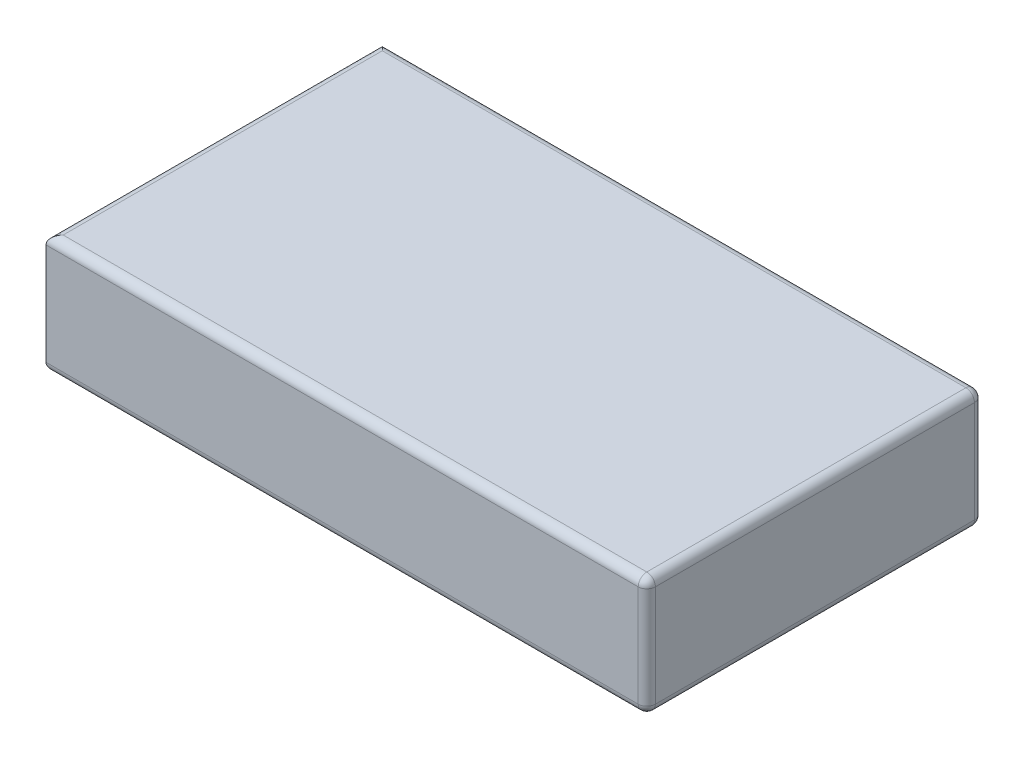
SolidWorks part; units mm, degrees
ref_plane "Front Plane" through (0, 0, 0) normal (0, 0, 1) x (1, 0, 0)
ref_plane "Top Plane" through (0, 0, 0) normal (0, 1, 0) x (1, 0, 0)
ref_plane "Right Plane" through (0, 0, 0) normal (1, 0, 0) x (0, 0, -1)
sketch "Sketch1" plane through (0, 0, 0) normal (1, 0, 0) x (0, 0, -1)
  line L1 (-9.795, 3.46) -> (9.795, 3.46)
  line L2 (-9.795, 3.46) -> (-9.795, -3.46)
  line L3 (-9.795, -3.46) -> (9.795, -3.46)
  line L4 (9.795, 3.46) -> (9.795, -3.46)
  line L5 (-9.795, 3.46) -> (9.795, -3.46) construction
  line L6 (-9.795, -3.46) -> (9.795, 3.46) construction
  point P0 (0, 0)
  dimension "D1" = 6.92
  dimension "D2" = 19.59
extrude "Boss-Extrude1" add sketch "Sketch1" along normal blind 35
sketch "Sketch3" plane through (0, 0, 0) normal (-1, 0, 0) x (0, 0, 1)
  line L0 (-5.858, 0) -> (-9.795, 0) construction
  line L1 (-9.795, -3.46) -> (-9.795, 3.46) construction
  line L2 (5.858, 0) -> (9.795, 0) construction
  line L3 (9.795, 3.46) -> (9.795, -3.46) construction
  circle A0 centre (-5.858, 0) radius 2.16
  circle A1 centre (5.858, 0) radius 2.16
  dimension "D1" = 4.32
  dimension "D2" = 3.937
extrude "Cut-Extrude3" cut sketch "Sketch3" against normal blind 12
fillet "Fillet1" radius 0.5 10 edges at (17.5, -3.46, 9.795) (35, -3.46, 0) (17.5, -3.46, -9.795) (0, -3.46, 0) (17.5, 3.46, -9.795) (35, 3.46, 0) (17.5, 3.46, 9.795) (0, 3.46, 0) (35, 0, 9.795) (35, 0, -9.795)
